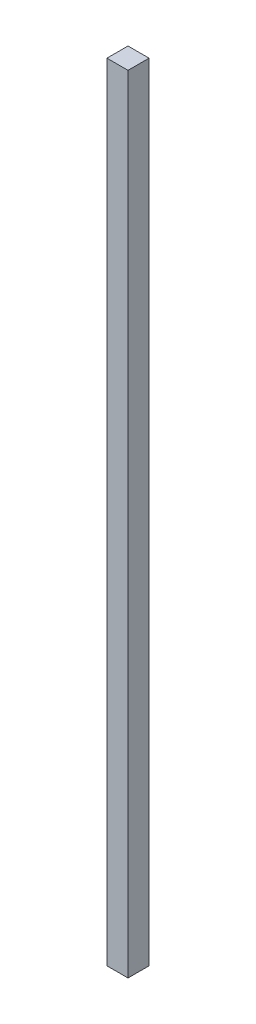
SolidWorks part; units mm, degrees
ref_plane "前视基准面" through (0, 0, 0) normal (0, 0, 1) x (1, 0, 0)
ref_plane "上视基准面" through (0, 0, 0) normal (0, 1, 0) x (1, 0, 0)
ref_plane "右视基准面" through (0, 0, 0) normal (1, 0, 0) x (0, 0, -1)
other "Configuration Table"
sketch "草图1" plane through (0, 0, 0) normal (0, 1, 0) x (1, 0, 0)
  line L1 (-30, 30) -> (30, 30)
  line L2 (-30, 30) -> (-30, -30)
  line L3 (-30, -30) -> (30, -30)
  line L4 (30, 30) -> (30, -30)
  line L5 (-30, 30) -> (30, -30) construction
  line L6 (-30, -30) -> (30, 30) construction
  point P0 (0, 0)
extrude "凸台-拉伸1" add sketch "草图1" along normal blind 2240
sketch "草图2" plane through (0, 0, 30) normal (0, 0, 1) x (1, 0, 0)
  line L0 (-30, 60) -> (30, 60)
  line L1 (-30, 2240) -> (-30, 0) construction
  line L2 (30, 2240) -> (30, 0) construction
  line L3 (-30, 0) -> (30, 0) construction
  line L4 (-30, 2180) -> (30, 2180)
  line L5 (-30, 2240) -> (30, 2240) construction
  dimension "D1" = 60
  dimension "D2" = 60
sketch "草图4" plane through (0, 0, 30) normal (0, 0, 1) x (1, 0, 0)
  line L0 (0, 2180) -> (0, 60)
  line L1 (-30, 2180) -> (30, 2180) construction
  line L2 (-30, 60) -> (30, 60) construction
